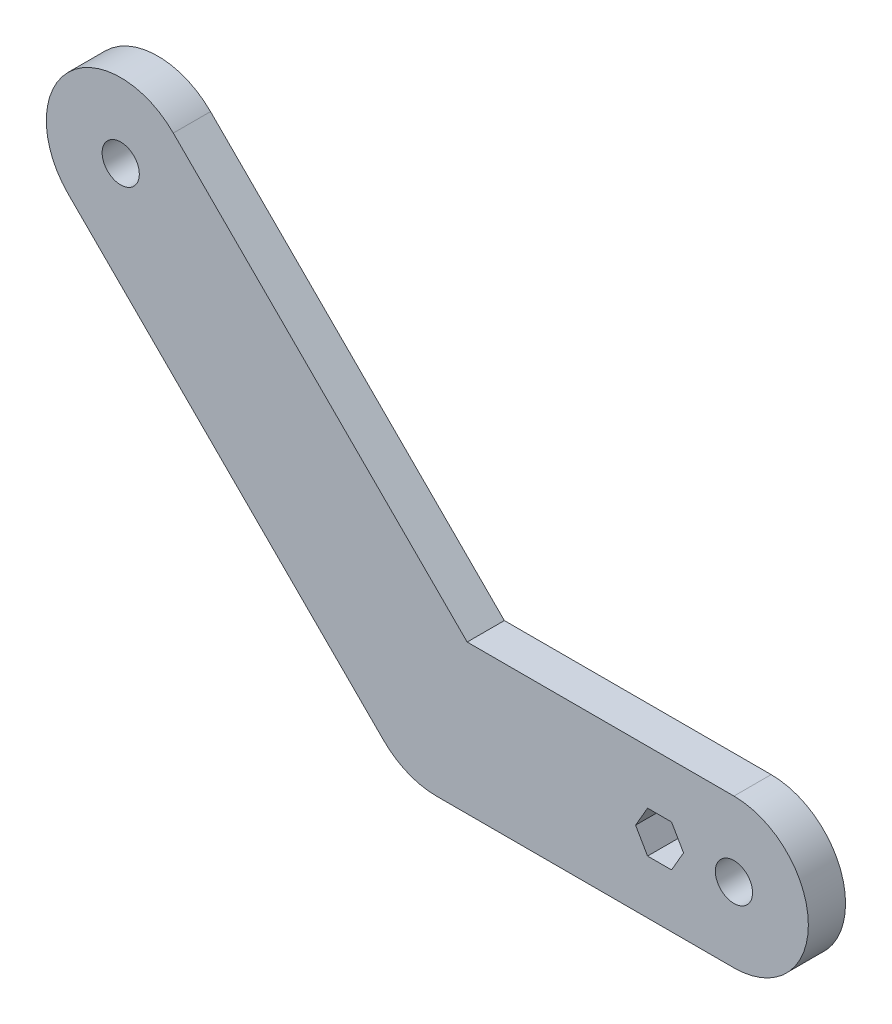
SolidWorks part; units mm, degrees
ref_plane "Front Plane" through (0, 0, 0) normal (0, 0, 1) x (1, 0, 0)
ref_plane "Top Plane" through (0, 0, 0) normal (0, 1, 0) x (1, 0, 0)
ref_plane "Right Plane" through (0, 0, 0) normal (1, 0, 0) x (0, 0, -1)
sketch "Sketch3" plane through (0, 0, 0) normal (0, 0, 1) x (1, 0, 0)
  line L0 (0, 0) -> (25.4, 0) construction
  line L1 (0, 6.35) -> (25.4, 6.35)
  line L2 (0, -6.35) -> (25.4, -6.35)
  line L4 (18.0269, 1.7721) -> (17.0038, 0)
  line L5 (17.0038, 0) -> (18.0269, -1.7721)
  line L6 (18.0269, -1.7721) -> (20.0731, -1.7721)
  line L7 (20.0731, -1.7721) -> (21.0962, 0)
  line L8 (21.0962, 0) -> (20.0731, 1.7721)
  line L9 (20.0731, 1.7721) -> (18.0269, 1.7721)
  arc A0 (0, 6.35) -> (0, -6.35) centre (0, 0) ccw
  arc A1 (25.4, -6.35) -> (25.4, 6.35) centre (25.4, 0) ccw
  circle A2 centre (25.4, 0) radius 1.5875
  circle A3 centre (19.05, 0) radius 1.7721 construction
  point P3 (12.7, 0)
  dimension "D2" = 6.35
  dimension "D3" = 3.175
  dimension "D1" = 25.4
  dimension "D4" = 6.35
extrude "Boss-Extrude2" add sketch "Sketch3" along normal blind 3.175
sketch "Sketch4" plane through (0, 0, 0) normal (0, 0, 1) x (1, 0, 0)
  line L0 (0, 0) -> (-26.9408, 26.9408) construction
  line L1 (-4.4901, -4.4901) -> (-31.4309, 22.4506)
  line L2 (4.4901, 4.4901) -> (-22.4506, 31.4309)
  line L3 (0, 0) -> (25.4, 0) construction
  arc A0 (-4.4901, -4.4901) -> (4.4901, 4.4901) centre (0, 0) ccw
  arc A1 (-22.4506, 31.4309) -> (-31.4309, 22.4506) centre (-26.9408, 26.9408) ccw
  circle A2 centre (-26.9408, 26.9408) radius 1.5875
  circle A3 centre (25.4, 0) radius 1.5875 construction
  arc A4 (0, 6.35) -> (0, -6.35) centre (0, 0) ccw construction
  point P3 (-13.4704, 13.4704)
  dimension "D2" = 135
  dimension "D1" = 38.1
extrude "Boss-Extrude3" add sketch "Sketch4" along normal blind 3.175
